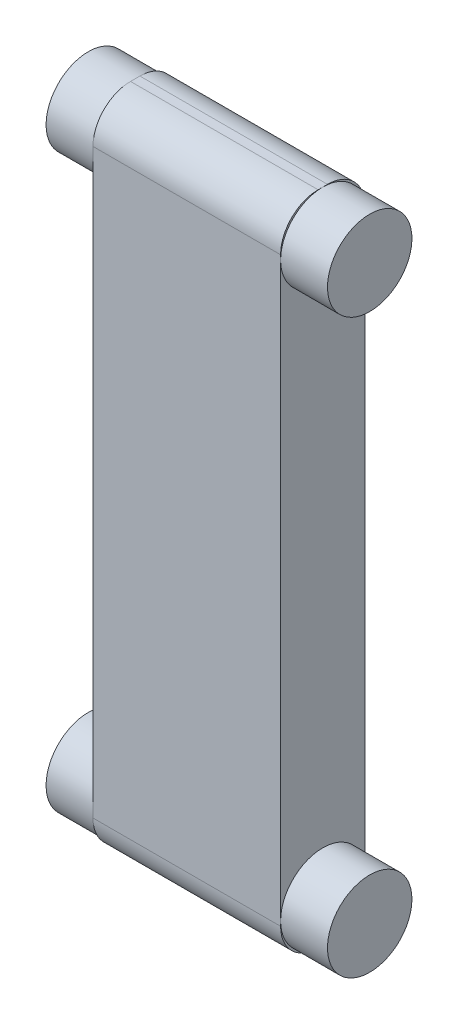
SolidWorks part; units mm, degrees
ref_plane "Front Plane" through (0, 0, 0) normal (0, 0, 1) x (1, 0, 0)
ref_plane "Top Plane" through (0, 0, 0) normal (0, 1, 0) x (1, 0, 0)
ref_plane "Right Plane" through (0, 0, 0) normal (1, 0, 0) x (0, 0, -1)
sketch "Sketch1" plane through (0, 0, 0) normal (0, 0, 1) x (1, 0, 0)
  line L0 (-75, 0) -> (75, 0)
  line L1 (-75, 0) -> (-75, 45)
  line L2 (-75, 45) -> (-50, 45)
  line L3 (-50, 45) -> (-50, 305)
  line L4 (-50, 305) -> (-75, 305)
  line L5 (-75, 305) -> (-75, 350)
  line L6 (-75, 350) -> (75, 350)
  line L7 (75, 350) -> (75, 305)
  line L8 (75, 305) -> (50, 305)
  line L9 (50, 305) -> (50, 45)
  line L10 (50, 45) -> (75, 45)
  line L11 (75, 45) -> (75, 0)
  point P4 (0, 0)
  dimension "D1" = 25
  dimension "D2" = 100
  dimension "D3" = 45
  dimension "D4" = 350
extrude "Boss-Extrude1" add sketch "Sketch1" along normal blind 45
sketch "Sketch2" plane through (75, 0, 0) normal (1, 0, 0) x (0, 0, -1)
  line L0 (-45, 305) -> (0, 305) construction
  line L1 (-45, 305) -> (-45, 350) construction
  line L2 (-45, 350) -> (0, 350) construction
  circle A0 centre (-22.5, 327.5) radius 22.5
  point P2 (0, 0)
  point P5 (-22.5, 305)
  point P8 (-45, 327.5)
sketch "Sketch5" plane through (-75, 0, 0) normal (-1, 0, 0) x (0, 0, 1)
  line L0 (45, 305) -> (0, 305) construction
  line L1 (0, 350) -> (0, 305) construction
  circle A0 centre (22.5, 327.5) radius 22.5
  point P4 (22.5, 305)
  point P7 (0, 327.5)
extrude "Cut-Extrude-Thin1" cut sketch "Sketch2" against normal up to surface (25 mm away) flip side to cut thin
extrude "Cut-Extrude-Thin2" cut sketch "Sketch5" against normal up to surface (25 mm away) flip side to cut thin
sketch "Sketch6" plane through (75, 0, 0) normal (1, 0, 0) x (0, 0, -1)
  line L0 (-45, 0) -> (-45, 45) construction
  line L2 (-45, 45) -> (0, 45) construction
  line L3 (-45, 0) -> (0, 0) construction
  line L4 (0, 0) -> (0, 45) construction
  circle A0 centre (-22.5, 22.5) radius 22.5
extrude "Cut-Extrude-Thin3" cut sketch "Sketch6" against normal up to surface (25 mm away) flip side to cut thin
sketch "Sketch7" plane through (-75, 0, 0) normal (-1, 0, 0) x (0, 0, 1)
  line L0 (0, 45) -> (0, 0) construction
  line L1 (45, 45) -> (0, 45) construction
  line L2 (45, 45) -> (45, 0) construction
  line L3 (45, 0) -> (0, 0) construction
  circle A0 centre (22.5, 22.5) radius 22.5
extrude "Cut-Extrude-Thin4" cut sketch "Sketch7" against normal up to surface (25 mm away) flip side to cut thin
fillet "Fillet3" radius 20 4 edges at (0, 350, 0) (0, 350, 45) (0, 0, 0) (0, 0, 45)
